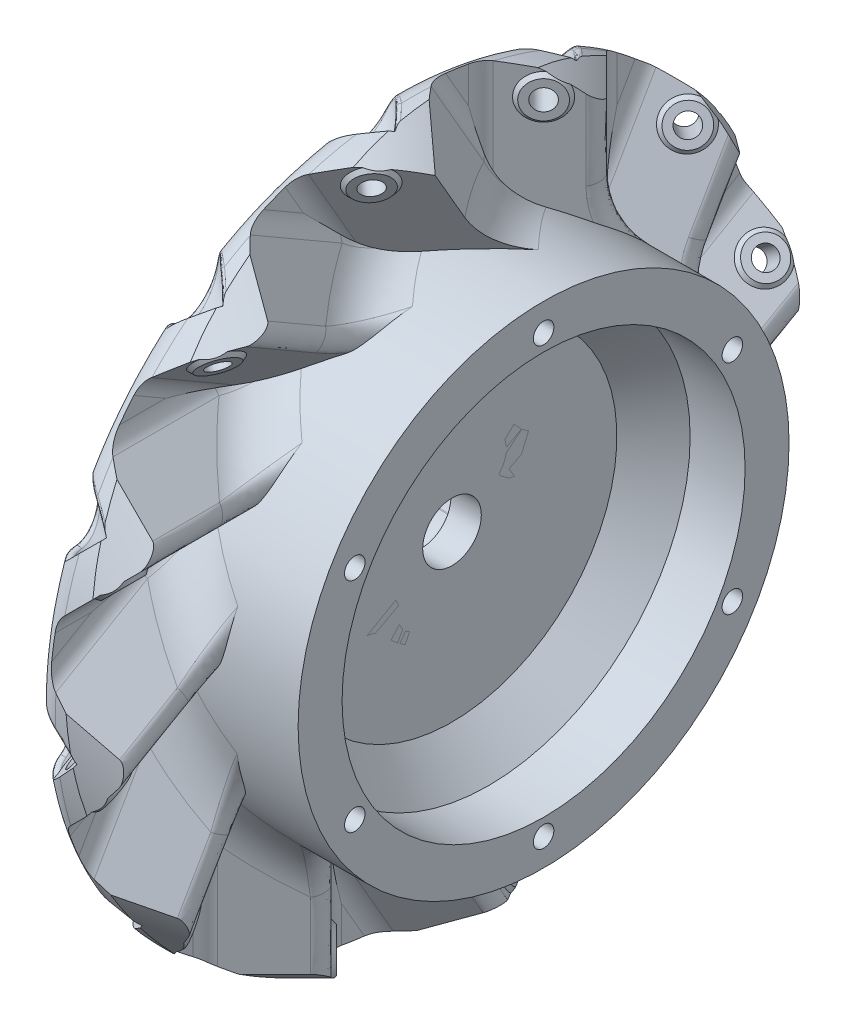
SolidWorks part; units mm, degrees
other "<MecanumA_pieza>-<Redondeo7>"
other "<MecanumA_pieza>-<Volumenkörper2[1]>"
ref_plane "Alzado" through (0, 0, 0) normal (0, 0, 1) x (1, 0, 0)
ref_plane "Planta" through (0, 0, 0) normal (0, 1, 0) x (1, 0, 0)
ref_plane "Vista lateral" through (0, 0, 0) normal (1, 0, 0) x (0, 0, -1)
ref_plane "Alzado-MecanumA_pieza_Simétrica" through (0, 0, 0) normal (0, 0, -1) x (1, 0, 0)
ref_plane "Planta-MecanumA_pieza_Simétrica" through (0, 0, 0) normal (0, 1, 0) x (1, 0, 0)
ref_plane "Vista lateral-MecanumA_pieza_Simétrica" through (0, 0, 0) normal (1, 0, 0) x (0, 0, 1)
mirrored part "MecanumA_pieza_Simétrica"
